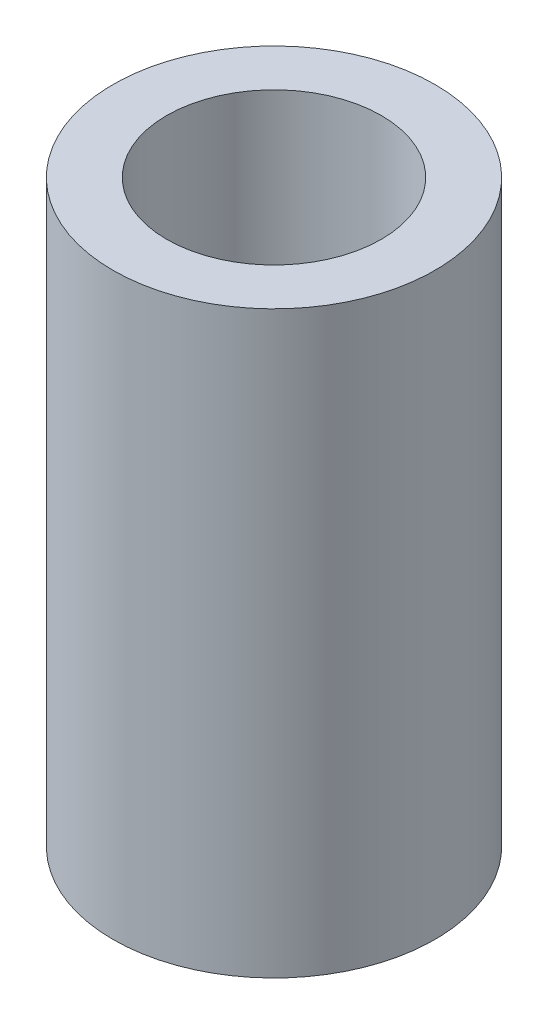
SolidWorks part; units mm, degrees
ref_plane "Front Plane" through (0, 0, 0) normal (0, 0, 1) x (1, 0, 0)
ref_plane "Top Plane" through (0, 0, 0) normal (0, 1, 0) x (1, 0, 0)
ref_plane "Right Plane" through (0, 0, 0) normal (1, 0, 0) x (0, 0, -1)
sketch "Sketch1" plane through (0, 0, 0) normal (0, 1, 0) x (1, 0, 0)
  circle A0 centre (0, 0) radius 6.35
  circle A1 centre (0, 0) radius 9.525
  dimension "D1" = 12.7
  dimension "D2" = 19.05
extrude "Boss-Extrude1" add sketch "Sketch1" along normal blind 34.29
